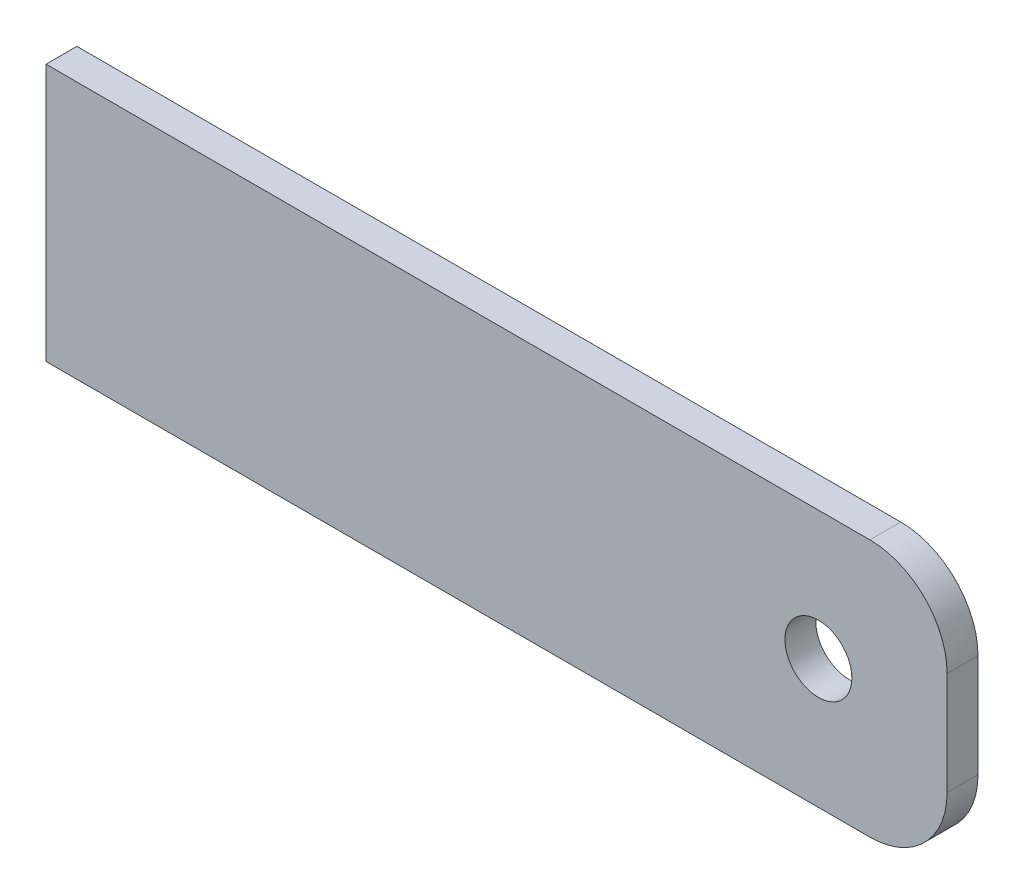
SolidWorks part; units mm, degrees
ref_plane "Face" through (0, 0, 0) normal (0, 0, 1) x (1, 0, 0)
ref_plane "Dessus" through (0, 0, 0) normal (0, 1, 0) x (1, 0, 0)
ref_plane "Droite" through (0, 0, 0) normal (1, 0, 0) x (0, 0, -1)
sketch "Esquisse1" plane through (0, 0, 0) normal (0, 0, 1) x (1, 0, 0)
  line L1 (0, 0) -> (320, 0)
  line L2 (0, 0) -> (0, -100)
  line L3 (0, -100) -> (320, -100)
  line L4 (350, -30) -> (350, -70)
  circle A0 centre (300, -50) radius 13
  arc A1 (320, 0) -> (350, -30) centre (320, -30) cw
  arc A2 (320, -100) -> (350, -70) centre (320, -70) ccw
  point P9 (350, 0)
  dimension "D3" = 26
  dimension "D6" = 30
  dimension "D1" = 350
  dimension "D2" = 100
  dimension "D4" = 50
  dimension "D5" = 300
extrude "Base-Extrusion" add sketch "Esquisse1" along normal blind 12
